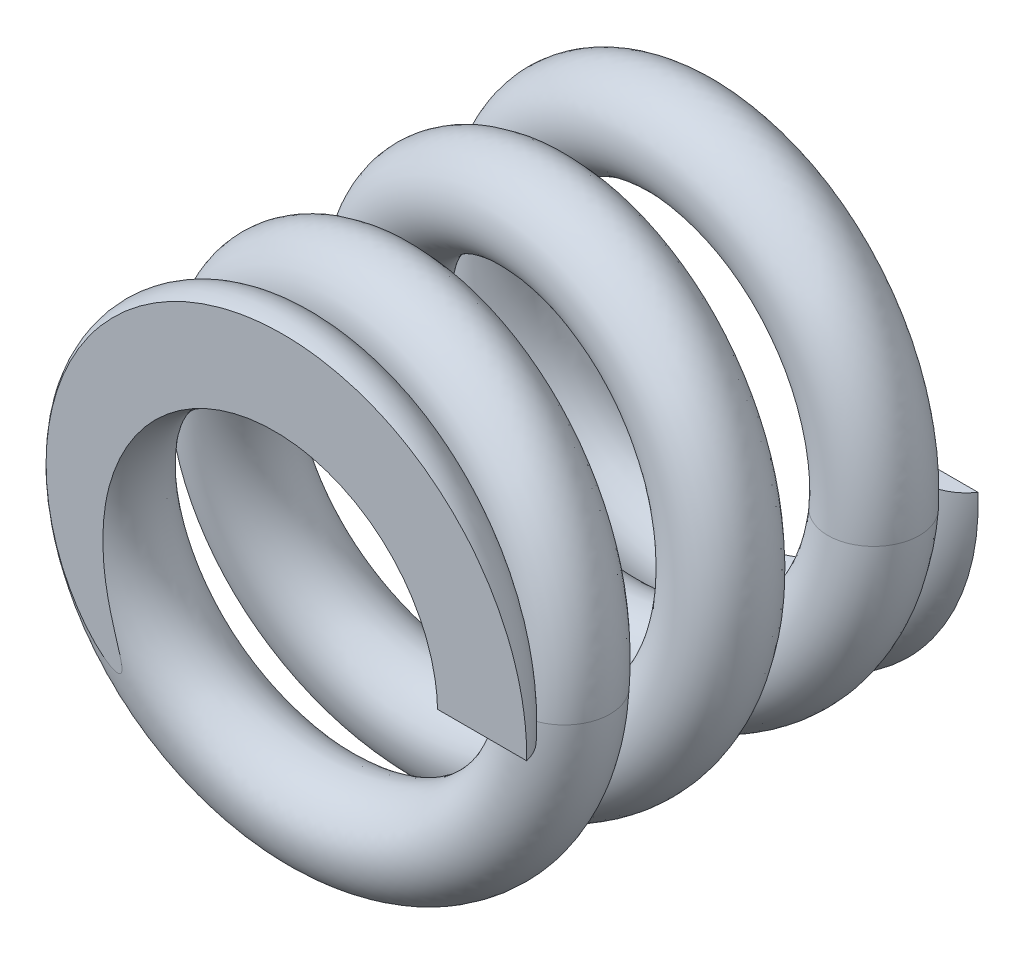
SolidWorks part; units mm, degrees
ref_plane "Front Plane" through (0, 0, 0) normal (0, 0, 1) x (1, 0, 0)
ref_plane "Top Plane" through (0, 0, 0) normal (0, 1, 0) x (1, 0, 0)
ref_plane "Right Plane" through (0, 0, 0) normal (1, 0, 0) x (0, 0, -1)
sketch "Sketch1" plane through (0, 0, 0) normal (0, 0, 1) x (1, 0, 0)
  circle A0 centre (0, 0) radius 6.1394
curve "Helix/Spiral1"
sketch "Sketch2" plane through (0, 0, 0) normal (0, 1, 0) x (1, 0, 0)
  circle A0 centre (4.5102, 0.0449) radius 1.016
  dimension "D1" = 2.032
sweep "Sweep1" add profiles "Sketch2" path "Helix/Spiral1"
sketch "Sketch5" plane through (0, 0, 0) normal (0, 1, 0) x (1, 0, 0)
  circle A1 centre (4.5102, 0.0449) radius 1.016
  circle A3 centre (4.5102, 0.0449) radius 1.016
  dimension "D1" = 0
sketch "Sketch6" plane through (0, 0, 0) normal (0, 0, 1) x (1, 0, 0)
  circle A0 centre (0, 0) radius 4.5958
curve "Helix/Spiral2"
sweep "Sweep2" add profiles "Sketch5" path "Helix/Spiral2"
sketch "Sketch7" plane through (0, 0, 0) normal (1, 0, 0) x (0, 0, -1)
  line L1 (1.524, 7.3532) -> (4.9074, 7.3532)
  line L2 (1.524, 7.3532) -> (1.524, -8.3401)
  line L3 (1.524, -8.3401) -> (4.9074, -8.3401)
  line L4 (4.9074, 7.3532) -> (4.9074, -8.3401)
  dimension "D1" = 1.524
extrude "Cut-Extrude3" cut sketch "Sketch7" against normal through all both and the other way through all
sketch "Sketch8" plane through (0, 0, 0) normal (0, -1, 0) x (-1, 0, 0)
  circle A1 centre (-4.5102, -6.8131) radius 1.016
  circle A2 centre (-4.5102, -6.8131) radius 1.016
  dimension "D1" = 0
ref_plane "Plane1" through (0, 0, 6.858) normal (0, 0, 1) x (1, 0, 0)
sketch "Sketch25" plane through (0, 0, 6.858) normal (0, 0, 1) x (1, 0, 0)
  circle A0 centre (0, 0) radius 4.5288
curve "Helix/Spiral5"
sweep "Sweep6" add profiles "Sketch8" path "Helix/Spiral5"
sketch "Sketch26" plane through (0, 0, 0) normal (0, 1, 0) x (1, 0, 0)
  line L0 (5.3456, 1.524) -> (3.6749, 1.524) construction
  line L1 (-10.3372, -8.636) -> (10.6132, -8.636)
  line L2 (-10.3372, -8.636) -> (-10.3372, -15.034)
  line L3 (-10.3372, -15.034) -> (10.6132, -15.034)
  line L4 (10.6132, -8.636) -> (10.6132, -15.034)
  dimension "D1" = 10.16
extrude "Cut-Extrude4" cut sketch "Sketch26" against normal through all both and the other way through all
